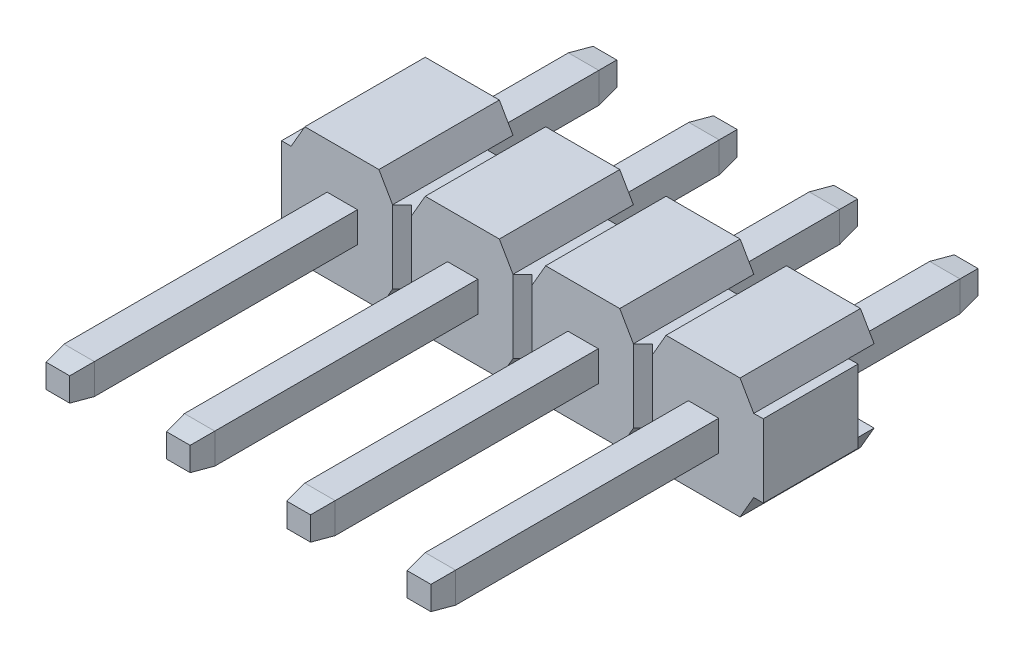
SolidWorks part; units mm, degrees
ref_plane "Front Plane" through (0, 0, 0) normal (0, 0, 1) x (1, 0, 0)
ref_plane "Top Plane" through (0, 0, 0) normal (0, 1, 0) x (1, 0, 0)
ref_plane "Right Plane" through (0, 0, 0) normal (1, 0, 0) x (0, 0, -1)
imported_body "CH31- BASE_04-1-solid1"
imported_body "PIN-1-solid1"
imported_body "PIN-2-solid1"
imported_body "PIN-3-solid1"
imported_body "PIN-4-solid1"
move or copy body "Body-Move/Copy1" bodies to move or copy 103 102 105 104 106 copy no rotation origin (0, 0, 0) rotation axis (0.5774, 0.5774, 0.5774) rotation angle 120
move or copy body "Body-Move/Copy2" bodies to move or copy 109 108 107 111 110 copy no translate (-101.66, 0.3024, 1.1854)
sketch "cell" plane through (0, 0, 0) normal (0, 0, 1) x (1, 0, 0)
  line L0 (-3.81, -1.27) -> (-4.6228, -2.286)
  line L1 (-4.6228, -2.286) -> (-2.9972, -2.286)
  line L2 (-2.9972, -2.286) -> (-3.81, -1.27)
  line L3 (-5.08, -1.27) -> (-5.08, 1.27)
  line L4 (-5.08, 1.27) -> (5.08, 1.27)
  line L5 (5.08, 1.27) -> (5.08, -1.27)
  line L6 (5.08, -1.27) -> (-5.08, -1.27)
  line L7 (-1.905, 0) -> (1.905, 0)
  line L8 (0, -1.905) -> (0, 1.905)
  line L9 (-4.699, -0.889) -> (-2.921, -0.889)
  line L10 (-2.921, -0.889) -> (-2.921, 0.889)
  line L11 (-2.921, 0.889) -> (-4.699, 0.889)
  line L12 (-4.699, 0.889) -> (-4.699, -0.889)
  line L13 (-4.699, -0.889) -> (-2.921, -0.889)
  line L14 (-2.921, -0.889) -> (-2.921, 0.889)
  line L15 (-2.921, 0.889) -> (-4.699, 0.889)
  line L16 (-4.699, 0.889) -> (-4.699, -0.889)
  line L17 (-5.1308, -1.27) -> (-5.1308, 1.3208)
  line L18 (-5.1308, 1.3208) -> (5.08, 1.3208)
  line L19 (5.08, 1.3208) -> (5.08, -1.27)
  line L20 (5.08, -1.27) -> (-5.1308, -1.27)
  line L21 (-3.81, -1.27) -> (-4.4196, -2.032)
  line L22 (-4.4196, -2.032) -> (-3.2004, -2.032)
  line L23 (-3.2004, -2.032) -> (-3.81, -1.27)
  line L24 (-5.08, -1.27) -> (-5.08, 1.27)
  line L25 (-5.08, 1.27) -> (5.08, 1.27)
  line L26 (5.08, 1.27) -> (5.08, -1.27)
  line L27 (5.08, -1.27) -> (-5.08, -1.27)
  line L28 (-4.7498, -0.9398) -> (-2.8702, -0.9398)
  line L29 (-2.8702, -0.9398) -> (-2.8702, 0.9398)
  line L30 (-2.8702, 0.9398) -> (-4.7498, 0.9398)
  line L31 (-4.7498, 0.9398) -> (-4.7498, -0.9398)
  line L32 (-4.7498, -0.9398) -> (-2.8702, -0.9398)
  line L33 (-2.8702, -0.9398) -> (-2.8702, 0.9398)
  line L34 (-2.8702, 0.9398) -> (-4.7498, 0.9398)
  line L35 (-4.7498, 0.9398) -> (-4.7498, -0.9398)
  circle A0 centre (0, 0) radius 1
  circle A1 centre (-3.81, 0) radius 0.508
  circle A2 centre (-1.27, 0) radius 0.508
  circle A3 centre (1.27, 0) radius 0.508
  circle A4 centre (3.81, 0) radius 0.508
  circle A5 centre (-3.81, 0) radius 0.508
  circle A6 centre (-1.27, 0) radius 0.508
  circle A7 centre (1.27, 0) radius 0.508
  circle A8 centre (3.81, 0) radius 0.508
  circle A9 centre (-1.27, 0) radius 0.889
  circle A10 centre (1.27, 0) radius 0.889
  circle A11 centre (3.81, 0) radius 0.889
  circle A12 centre (-1.27, 0) radius 0.889
  circle A13 centre (1.27, 0) radius 0.889
  circle A14 centre (3.81, 0) radius 0.889
  circle A15 centre (-1.27, 0) radius 1.016
  circle A16 centre (1.27, 0) radius 1.016
  circle A17 centre (3.81, 0) radius 1.016
  circle A18 centre (-1.27, 0) radius 1.016
  circle A19 centre (1.27, 0) radius 1.016
  circle A20 centre (3.81, 0) radius 1.016
  text T0 "Ref Des" font "ARIAL" height 1.016
  text T1 "B" font "ARIAL" height 1
  text T2 "1" font "COURIER NEW" height 0.508
  text T3 "2" font "COURIER NEW" height 0.508
  text T4 "3" font "COURIER NEW" height 0.508
  text T5 "4" font "COURIER NEW" height 0.508
  text T6 "Ref Des" font "CENTURY GOTHIC" height 1.016
